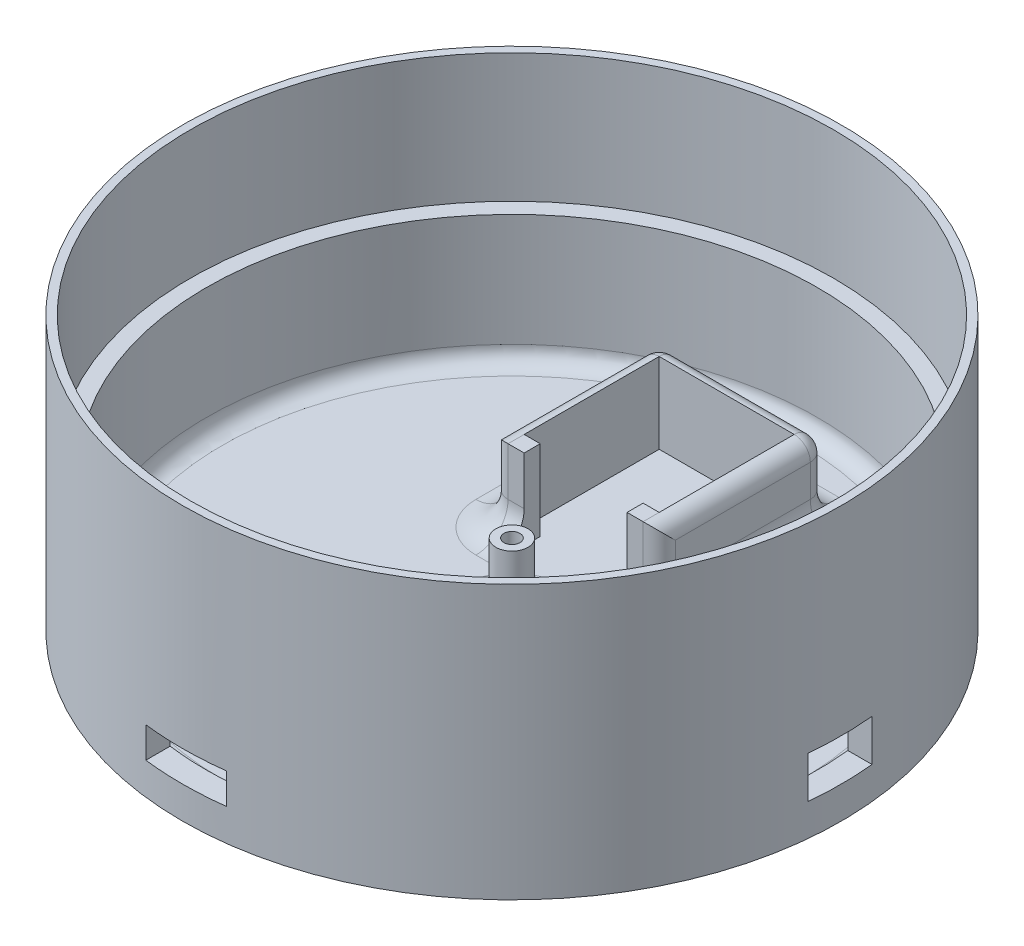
SolidWorks part; units mm, degrees
ref_plane "Front Plane" through (0, 0, 0) normal (0, 0, 1) x (1, 0, 0)
ref_plane "Top Plane" through (0, 0, 0) normal (0, 1, 0) x (1, 0, 0)
ref_plane "Right Plane" through (0, 0, 0) normal (1, 0, 0) x (0, 0, -1)
sketch "Sketch1" plane through (0, 0, 0) normal (0, 1, 0) x (1, 0, 0)
  circle A0 centre (0, 0) radius 102.5
  dimension "D1" = 205
extrude "Boss-Extrude1" add sketch "Sketch1" along normal blind 5
sketch "Sketch2" plane through (0, 5, 0) normal (0, 1, 0) x (1, 0, 0)
  circle A0 centre (0, 0) radius 102.5
  circle A1 centre (0, 0) radius 100
  dimension "D1" = 200
extrude "Boss-Extrude2" add sketch "Sketch2" along normal blind 80
sketch "Sketch3" plane through (0, 5, 0) normal (0, 1, 0) x (1, 0, 0)
  circle A0 centre (0, 0) radius 100
  circle A1 centre (0, 0) radius 95
  dimension "D1" = 5
extrude "Boss-Extrude3" add sketch "Sketch3" along normal blind 40
sketch "Sketch4" plane through (0, 5, 0) normal (0, 1, 0) x (1, 0, 0)
  line L0 (0, 99.5) -> (0, 45.8) construction
  line L1 (-21, 66.8) -> (21, 66.8)
  line L2 (-21, 66.8) -> (-21, 24.8)
  line L3 (-21, 24.8) -> (-16, 24.8)
  line L4 (21, 66.8) -> (21, 24.8)
  line L5 (-21, 66.8) -> (21, 24.8) construction
  line L6 (-21, 24.8) -> (21, 66.8) construction
  line L7 (26, 71.8) -> (26, 19.8)
  line L8 (-26, 19.8) -> (-16, 19.8)
  line L9 (-26, 71.8) -> (-26, 19.8)
  line L10 (-26, 71.8) -> (26, 71.8)
  line L11 (-16, 24.8) -> (-16, 19.8)
  line L12 (16, 24.8) -> (16, 19.8)
  line L13 (-26, 19.8) -> (26, 19.8) construction
  line L14 (16, 24.8) -> (21, 24.8)
  line L15 (-21, 24.8) -> (21, 24.8) construction
  line L17 (26, 19.8) -> (16, 19.8)
  circle A2 centre (0, 45.8) radius 2.5 construction
  circle A3 centre (0, 0) radius 99.5 construction
  point P0 (0, 45.8)
  point P10 (0, 0)
  point P11 (0, 0)
  dimension "D1" = 53.7
  dimension "D5" = 5
  dimension "D9" = 199
  dimension "D2" = 42
  dimension "D3" = 42
  dimension "D7" = 10
  dimension "D8" = 10
  dimension "D6" = 5
extrude "Boss-Extrude4" add sketch "Sketch4" along normal blind 25
sketch "Sketch5" plane through (0, 0, 0) normal (0, 0, 1) x (1, 0, 0)
  line L0 (-102.5, 0) -> (102.5, 0) construction
  line L1 (-12.0742, 19.5682) -> (12.9258, 19.5682)
  line L2 (-12.0742, 19.5682) -> (-12.0742, 10)
  line L3 (-12.0742, 10) -> (12.9258, 10)
  line L4 (12.9258, 19.5682) -> (12.9258, 10)
  dimension "D1" = 10
  dimension "D2" = 25
extrude "Cut-Extrude1" cut sketch "Sketch5" along normal blind 129
sketch "Sketch6" plane through (0, 0, 0) normal (1, 0, 0) x (0, 0, -1)
  line L0 (-102.5, 0) -> (102.5, 0) construction
  line L1 (-10, 23) -> (10, 23)
  line L2 (-10, 23) -> (-10, 10)
  line L3 (-10, 10) -> (10, 10)
  line L4 (10, 23) -> (10, 10)
  line L5 (-10, 23) -> (10, 10) construction
  line L6 (-10, 10) -> (10, 23) construction
  line L7 (0, 16.5) -> (0, -0.8857) construction
  dimension "D1" = 10
  dimension "D2" = 13
  dimension "D3" = 20
  dimension "D4" = 0
extrude "Cut-Extrude2" cut sketch "Sketch6" along normal blind 150
fillet "Fillet3" radius 5 8 edges at (0, 5, 95) (26, 17.5, -71.8) (-26, 17.5, -71.8) (-26, 17.5, -19.8) (26, 17.5, -19.8) (0, 30, -71.8) (-26, 30, -45.8) (26, 30, -45.8)
shell "Shell2" thickness 1
sketch "Sketch7" plane through (0, 5, 0) normal (0, 1, 0) x (1, 0, 0)
  line L0 (0, 99.5) -> (0, 45.8) construction
  circle A0 centre (0, 0) radius 99.5
  circle A1 centre (0, 45.8) radius 2.5
  point P6 (0, 0)
  dimension "D1" = 199
  dimension "D3" = 5
  dimension "D2" = 53.7
sketch "Sketch8" plane through (0, 5, 0) normal (0, 1, 0) x (1, 0, 0)
  circle A0 centre (0, 0) radius 2.5
  circle A1 centre (0, 0) radius 5
  dimension "D1" = 5
  dimension "D2" = 10
extrude "Boss-Extrude7" add sketch "Sketch8" along normal blind 20
fillet "Fillet4" radius 10 1 edges at (0, 5, 5)
fillet "Fillet5" radius 10 9 edges at (0, 5, -71.8) (26, 5, -45.8) (-26, 5, -45.8) (-18.5, 5, -19.8) (24.5355, 5, -70.3355) (-24.5355, 5, -70.3355) (-24.5355, 5, -21.2645) (24.5355, 5, -21.2645) (18.5, 5, -19.8)
